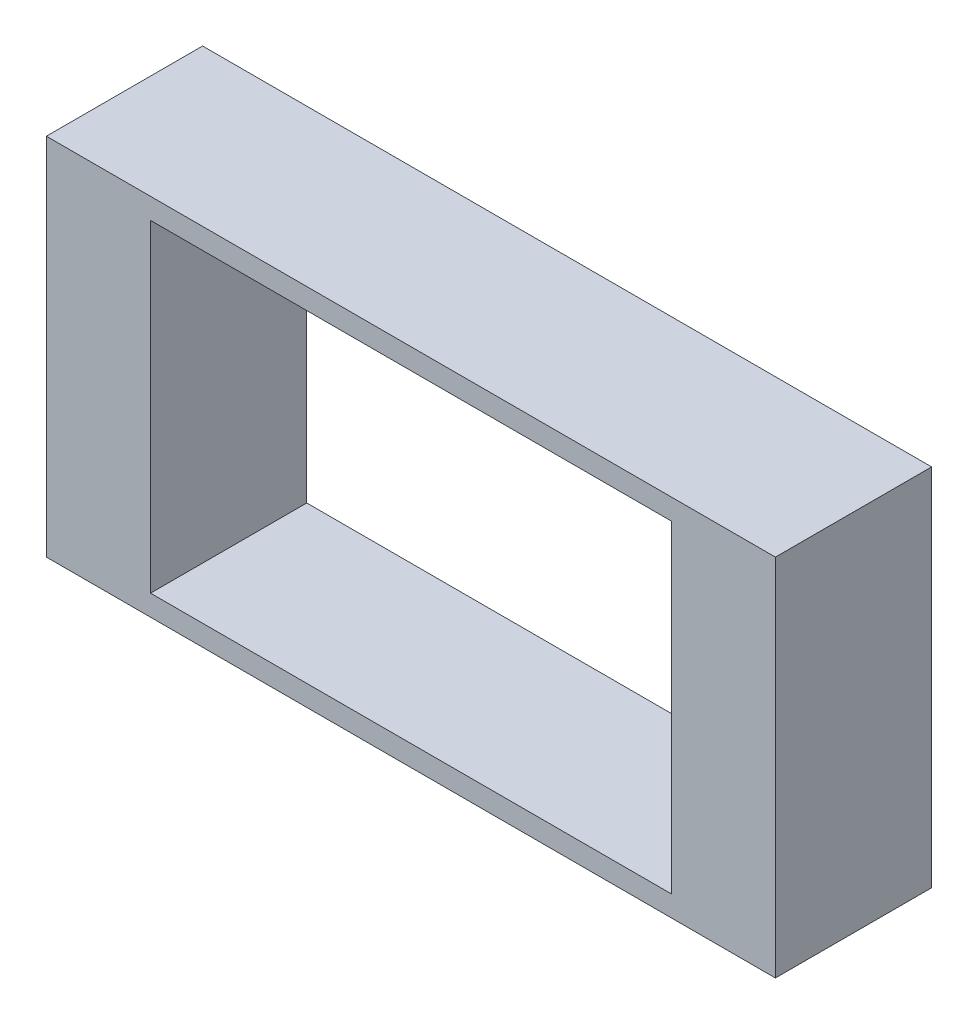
SolidWorks part; units mm, degrees
ref_plane "Plan de face" through (0, 0, 0) normal (0, 0, 1) x (1, 0, 0)
ref_plane "Plan de dessus" through (0, 0, 0) normal (0, 1, 0) x (1, 0, 0)
ref_plane "Plan de droite" through (0, 0, 0) normal (1, 0, 0) x (0, 0, -1)
sketch "Esquisse1" plane through (0, 0, 0) normal (0, 0, 1) x (1, 0, 0)
  line L0 (0, -55) -> (0, 55) construction
  line L1 (-35, 17.5) -> (35, 17.5)
  line L2 (-35, 17.5) -> (-35, -17.5)
  line L3 (-35, -17.5) -> (35, -17.5)
  line L4 (35, 17.5) -> (35, -17.5)
  line L5 (55, 0) -> (-55, 0) construction
  line L7 (-25, 15.5) -> (25, 15.5)
  line L8 (-25, 15.5) -> (-25, -15.5)
  line L9 (-25, -15.5) -> (25, -15.5)
  line L10 (25, 15.5) -> (25, -15.5)
  dimension "D1" = 70
  dimension "D2" = 35
  dimension "D3" = 35
  dimension "D4" = 17.5
  dimension "D5" = 10
  dimension "D6" = 10
  dimension "D7" = 2
  dimension "h" = 2
extrude "Boss.-Extru.1" add sketch "Esquisse1" along normal blind 15
equation "\"h\"=3.27403"
